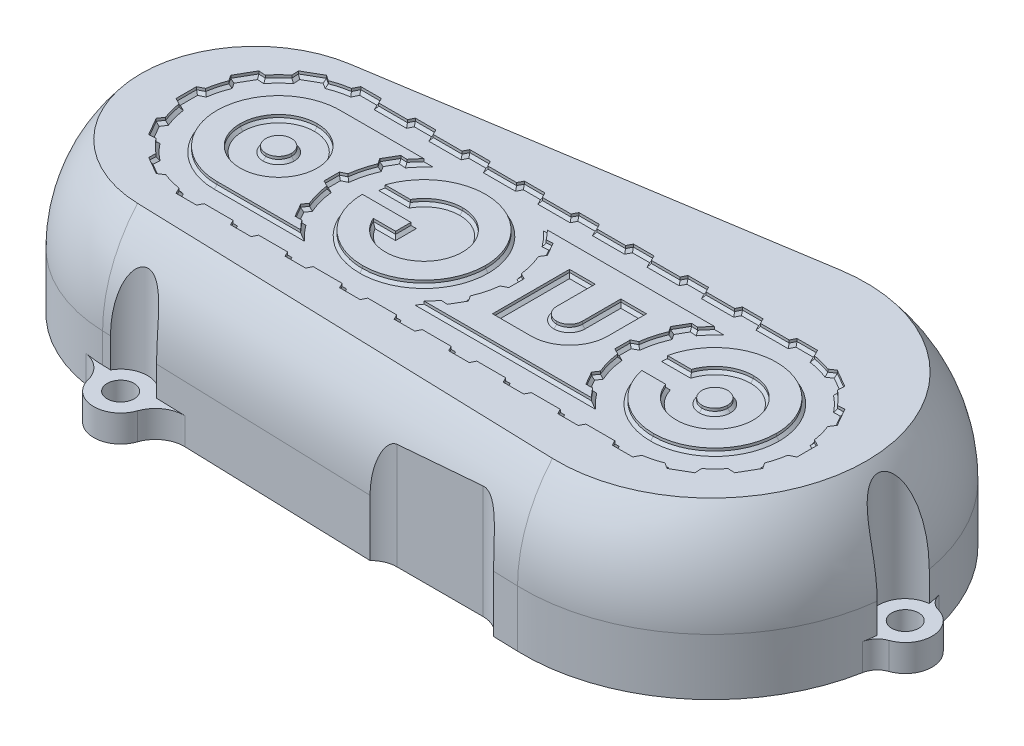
SolidWorks part; units mm, degrees
other "<V3coverL5>-<V3coverL5.step<1>[1]>"
ref_plane "正面" through (0, 0, 0) normal (0, 0, 1) x (1, 0, 0)
ref_plane "平面" through (0, 0, 0) normal (0, 1, 0) x (1, 0, 0)
ref_plane "右側面" through (0, 0, 0) normal (1, 0, 0) x (0, 0, -1)
mirrored part "V3coverL5_ﾐﾗｰ ｺﾋﾟｰ"
